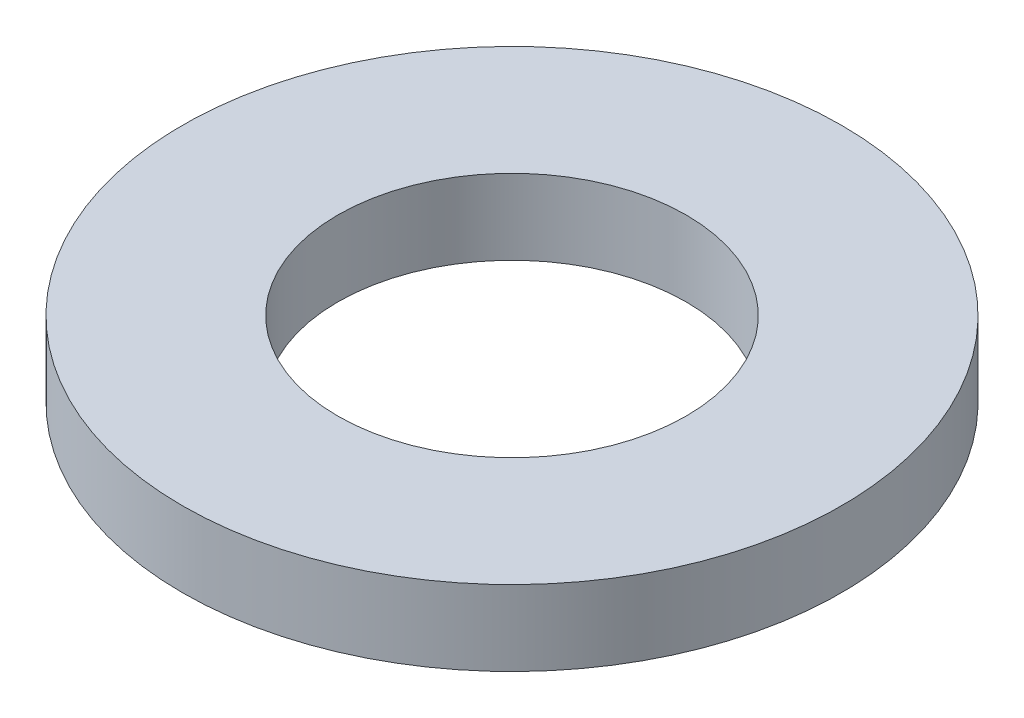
SolidWorks part; units mm, degrees
ref_plane "Front" through (0, 0, 0) normal (0, 0, 1) x (1, 0, 0)
ref_plane "Top" through (0, 0, 0) normal (0, 1, 0) x (1, 0, 0)
ref_plane "Right" through (0, 0, 0) normal (1, 0, 0) x (0, 0, -1)
sketch "Sketch1" plane through (0, 0, 0) normal (0, 1, 0) x (1, 0, 0)
  circle A0 centre (0, 0) radius 3.7
  circle A1 centre (0, 0) radius 7
extrude "Extrude1" add sketch "Sketch1" along normal blind 1.6
